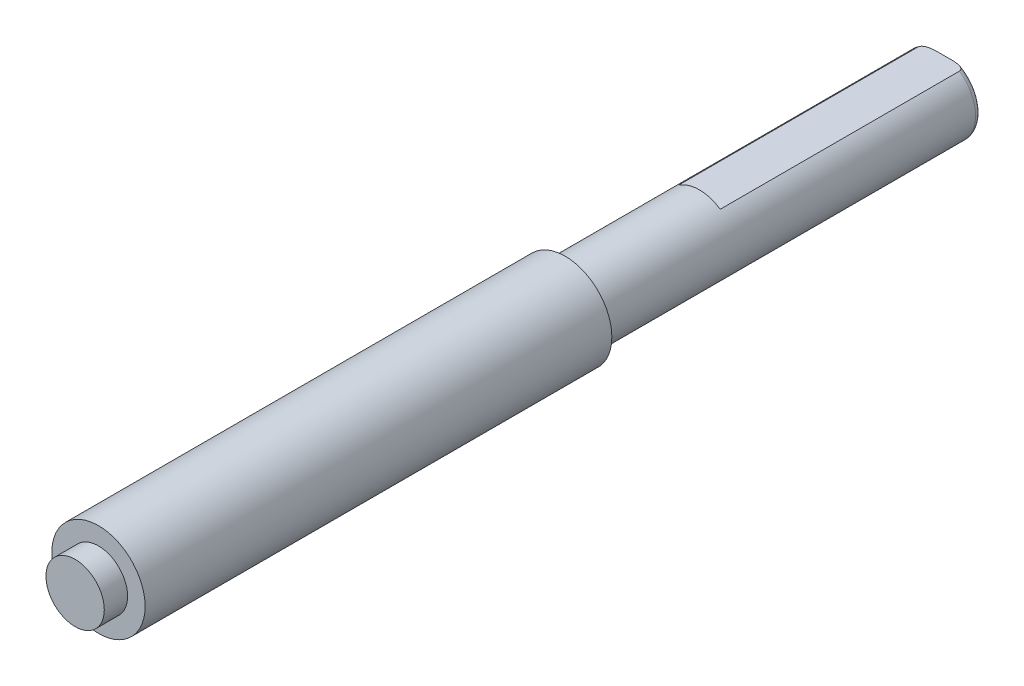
SolidWorks part; units mm, degrees
ref_plane "前视" through (0, 0, 0) normal (0, 0, 1) x (1, 0, 0)
ref_plane "上视" through (0, 0, 0) normal (0, 1, 0) x (1, 0, 0)
ref_plane "右视" through (0, 0, 0) normal (1, 0, 0) x (0, 0, -1)
sketch "草图2" plane through (0, 0, 0) normal (0, 0, 1) x (1, 0, 0)
  circle A0 centre (0, 0) radius 3.175
extrude "凸台-拉伸1" add sketch "草图2" along normal blind 32.5
sketch "草图3" plane through (0, 0, 32.5) normal (0, 0, 1) x (1, 0, 0)
  circle A0 centre (0, 0) radius 4
extrude "凸台-拉伸2" add sketch "草图3" along normal blind 40
sketch "草图4" plane through (0, 0, 0) normal (0, 0, -1) x (-1, 0, 0)
  line L0 (-1.7861, 2.625) -> (1.7861, 2.625)
  arc A0 (1.7861, 2.625) -> (-1.7861, 2.625) centre (0, 0) ccw
extrude "切除-拉伸1" cut sketch "草图4" against normal blind 21
sketch "草图5" plane through (0, 0, 72.5) normal (0, 0, 1) x (1, 0, 0)
  circle A0 centre (0, 0) radius 2.5
extrude "凸台-拉伸3" add sketch "草图5" along normal blind 2
fillet "圆角1" radius 0.5 1 edges at (0, -3.175, 0)
